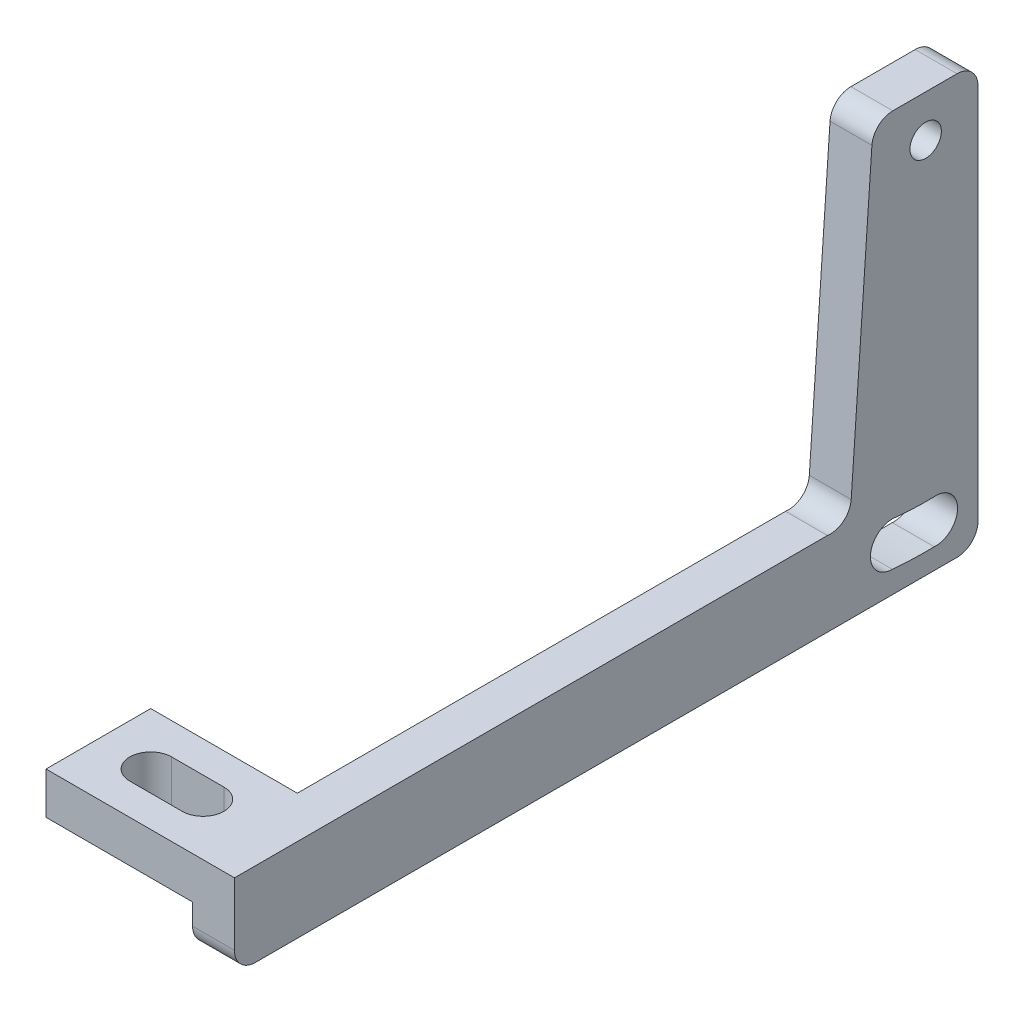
SolidWorks part; units mm, degrees
ref_plane "Front Plane" through (0, 0, 0) normal (0, 0, 1) x (1, 0, 0)
ref_plane "Top Plane" through (0, 0, 0) normal (0, 1, 0) x (1, 0, 0)
ref_plane "Right Plane" through (0, 0, 0) normal (1, 0, 0) x (0, 0, -1)
sketch "Sketch1" plane through (0, 0, 0) normal (1, 0, 0) x (0, 0, -1)
  line L0 (-4.9768, 6.35) -> (4.7625, 6.35)
  line L1 (7.9375, 3.175) -> (7.9375, -53.975)
  line L2 (4.7625, -57.15) -> (-101.6, -57.15)
  line L3 (-104.775, -53.975) -> (-104.775, -44.45)
  line L4 (-88.9, -44.45) -> (-14.8946, -44.45)
  line L5 (-11.2854, -41.5274) -> (-8.144, 3.3965)
  line L6 (-1.7634, -50.4972) -> (0, 0) construction
  line L10 (-104.775, -44.45) -> (-88.9, -44.45)
  circle A0 centre (0, 0) radius 2.3813
  arc A1 (-4.4095, -47.261) -> (-5.0654, -53.7992) centre (-5.0654, -50.4972) ccw
  arc A2 (4.7625, 6.35) -> (7.9375, 3.175) centre (4.7625, 3.175) cw
  arc A3 (-1.7654, -50.613) -> (-1.7675, -50.7211) centre (1.5345, -50.7288) ccw
  arc A4 (-5.0654, -47.1952) -> (1.7514, -47.4339) centre (0, 0) ccw
  arc A5 (-5.0654, -53.7992) -> (1.29, -54.0217) centre (0, 0) ccw
  arc A6 (-1.7709, -50.7196) -> (-1.7634, -50.4972) centre (-5.0654, -50.4972) ccw
  arc A7 (1.29, -54.0217) -> (1.1189, -47.4531) centre (1.5345, -50.7288) ccw
  arc A8 (-4.9768, 6.35) -> (-8.144, 3.3965) centre (-4.9768, 3.175) ccw
  arc A9 (7.9375, -53.975) -> (4.7625, -57.15) centre (4.7625, -53.975) cw
  arc A10 (-14.8946, -44.45) -> (-11.2854, -41.5274) centre (-14.4527, -41.3059) ccw
  arc A11 (-101.6, -57.15) -> (-104.775, -53.975) centre (-101.6, -53.975) cw
  point P23 (7.9375, 6.35)
  point P26 (-7.9375, 6.35)
  point P29 (7.9375, -57.15)
  point P35 (-104.775, -57.15)
  dimension "D1" = 63.5
  dimension "D4" = 6.604
  dimension "D5" = 45.085
  dimension "D7" = 4.7625
  dimension "D8" = 6.604
  dimension "D10" = 6.5999
  dimension "D11" = 3.175
  dimension "D12" = 104.775
  dimension "D15" = 3.175
  dimension "D2" = 6.35
  dimension "D3" = 7.9375
  dimension "D6" = 15.875
  dimension "D9" = 2
  dimension "D13" = 15.875
  dimension "D14" = 12.7
  dimension "D16" = 4
extrude "Extrude1" add sketch "Sketch1" along normal blind 6.35
sketch "Sketch3" plane through (0, 0, 0) normal (-1, 0, 0) x (0, 0, 1)
  line L0 (104.775, -53.975) -> (104.775, -44.45) construction
  line L1 (88.9, -44.45) -> (104.775, -44.45)
  line L2 (88.9, -44.45) -> (88.9, -50.8)
  line L3 (88.9, -50.8) -> (104.775, -50.8)
  line L4 (104.775, -44.45) -> (104.775, -50.8)
  line L5 (104.775, -44.45) -> (14.8946, -44.45) construction
  dimension "D1" = 6.35
  dimension "D2" = 15.875
extrude "Extrude2" add sketch "Sketch3" along normal blind 22.225
sketch "Sketch4" plane through (0, -44.45, 0) normal (0, 1, 0) x (-1, 0, 0)
  line L0 (0, 88.9) -> (0, 14.8946) construction
  line L1 (6.35, 100.0125) -> (14.2875, 100.0125)
  line L2 (6.35, 93.6625) -> (14.2875, 93.6625)
  line L3 (-6.35, 104.775) -> (22.225, 104.775) construction
  arc A0 (6.35, 100.0125) -> (6.35, 93.6625) centre (6.35, 96.8375) ccw
  arc A1 (14.2875, 93.6625) -> (14.2875, 100.0125) centre (14.2875, 96.8375) ccw
  dimension "D1" = 6.35
  dimension "D3" = 7.9375
  dimension "D4" = 7.9375
  dimension "D2" = 6.35
extrude "Cut-Extrude1" cut sketch "Sketch4" against normal through all
